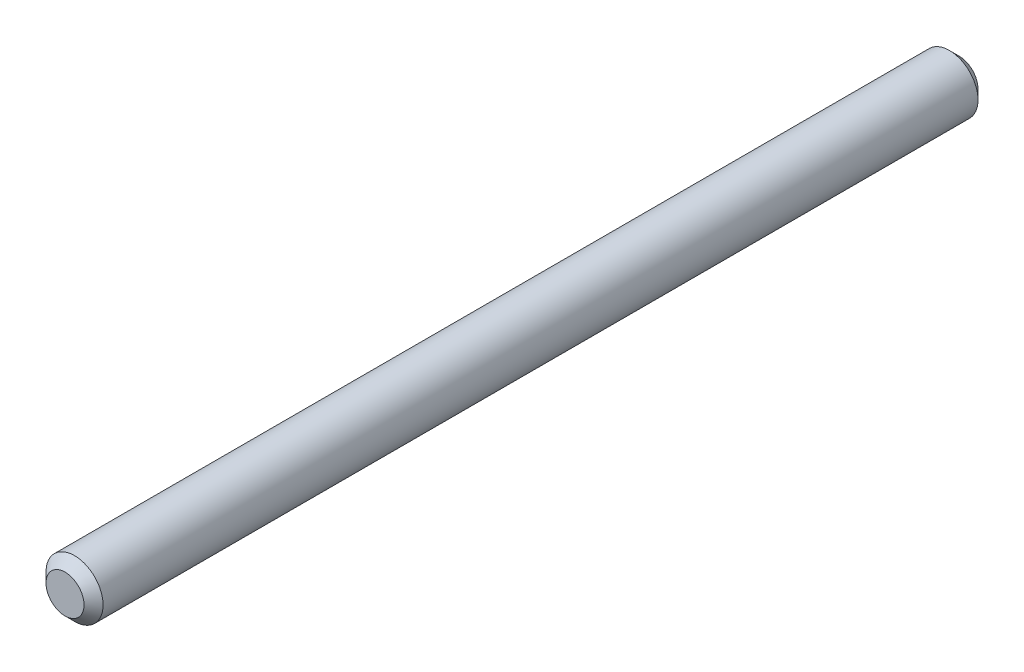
SolidWorks part; units mm, degrees
ref_plane "Face" through (0, 0, 0) normal (0, 0, 1) x (1, 0, 0)
ref_plane "Dessus" through (0, 0, 0) normal (0, 1, 0) x (1, 0, 0)
ref_plane "Droite" through (0, 0, 0) normal (1, 0, 0) x (0, 0, -1)
sketch "Esquisse1" plane through (0, 0, 0) normal (0, 0, 1) x (1, 0, 0)
  circle A0 centre (0, 0) radius 1.5
extrude "Base-Extrusion" add sketch "Esquisse1" along normal blind 47
chamfer "Chanfrein1" distance 0.5 angle 45 2 edges at (1.5, 0, 0) (1.5, 0, 47)
